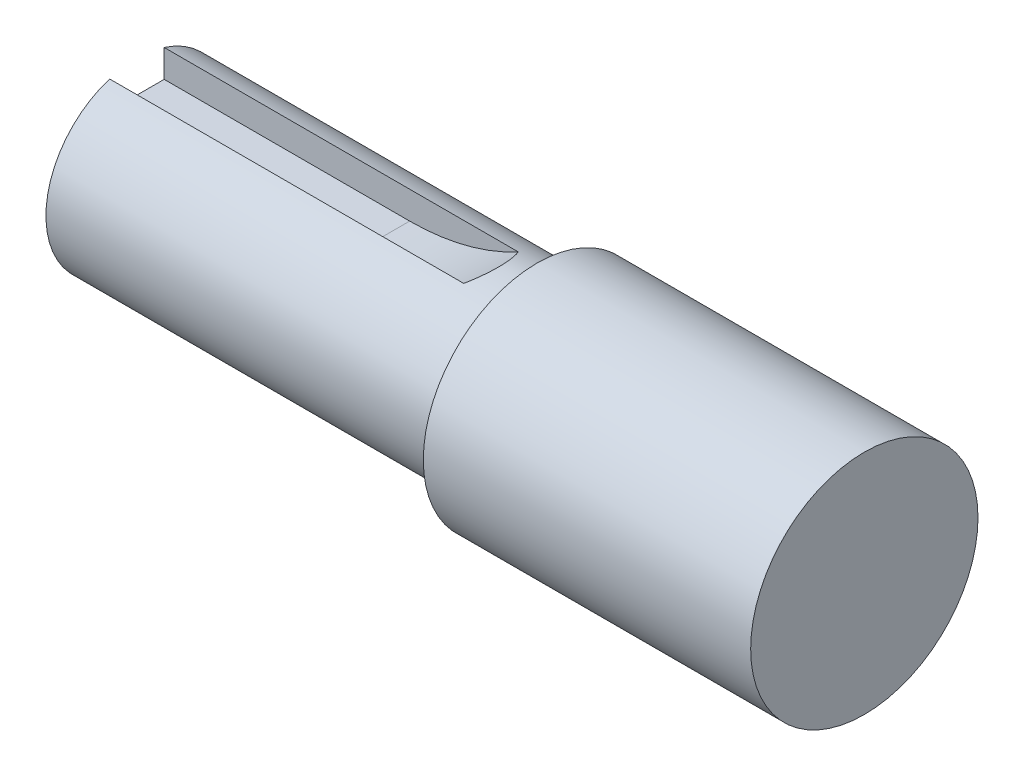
SolidWorks part; units mm, degrees
ref_plane "Plan1" through (0, 0, 0) normal (0, 0, 1) x (1, 0, 0)
ref_plane "Plan2" through (0, 0, 0) normal (0, 1, 0) x (1, 0, 0)
ref_plane "Plan3" through (0, 0, 0) normal (1, 0, 0) x (0, 0, -1)
sketch "Esquisse1" plane through (0, 0, 0) normal (0, 0, 1) x (1, 0, 0)
  line L0 (0, 12.5) -> (36, 12.5)
  line L1 (36, 12.5) -> (36, 0)
  line L2 (36, 0) -> (-44, 0)
  line L3 (-44, 0) -> (-44, 10)
  line L4 (-44, 10) -> (0, 10)
  line L5 (0, 10) -> (0, 12.5)
  line L6 (-70, 0) -> (70, 0) construction
  dimension "D1" = 36
  dimension "D2" = 44
  dimension "D3" = 25
  dimension "D4" = 20
revolve "Base-Révolution" add sketch "Esquisse1" angle 360 about L6
sketch "Esquisse2" plane through (-44, 0, 0) normal (-1, 0, 0) x (0, 0, 1)
  line L1 (-3, 6.5) -> (3, 6.5)
  line L2 (-3, 6.5) -> (-3, 10)
  line L3 (-3, 10) -> (3, 10)
  line L4 (3, 6.5) -> (3, 10)
  circle A0 centre (0, 0) radius 10 construction
  dimension "D1" = 6.5
  dimension "D2" = 6
extrude "Enlèv. mat.-Extru.1" cut sketch "Esquisse2" against normal blind 27
sketch "Esquisse3" plane through (0, 0, -3) normal (0, 0, 1) x (1, 0, 0)
  line L0 (-17, 6.5) -> (-44, 6.5) construction
  line L1 (-17, 9.5394) -> (-17, 6.5) construction
  circle A0 centre (-17, 31.5) radius 25
  dimension "D1" = 50
extrude "Enlèv. mat.-Extru.2" cut sketch "Esquisse3" against normal up to surface (6 mm away)
hole_wizard "Perçage1" positions "Esquisse5" profile "Esquisse4" tap size "M8x1.25" standard "Ansi Métrique"
sketch "Esquisse5" plane through (-44, 0, 0) normal (-1, 0, 0) x (0, 0, 1)
  arc A0 (-3, 9.5394) -> (3, 9.5394) centre (0, 0) ccw construction
  point P0 (0, 0)
sketch "Esquisse4" plane through (-44, 0, 0) normal (0, 1, 0) x (0, 0, 1)
  line L0 (0, 0) -> (0, 38.0429)
  line L1 (0, 38.0429) -> (3.4, 36)
  line L2 (3.4, 36) -> (3.4, 30)
  line L3 (3.4, 30) -> (4, 30)
  line L4 (4, 30) -> (4, 0)
  line L5 (4, 0) -> (0, 0)
  line L10 (0, 38.0429) -> (-3.4, 36) construction
  line L11 (0, -6.35) -> (0, 107.95) construction
  dimension "Diamètre du trou pour taraudage" = 6.8
  dimension "Profondeur du trou pour taraudage" = 36
  dimension "Diamètre du filetage" = 8
  dimension "Profondeur du filetage" = 30
  dimension "Angle de pointe" = 118
